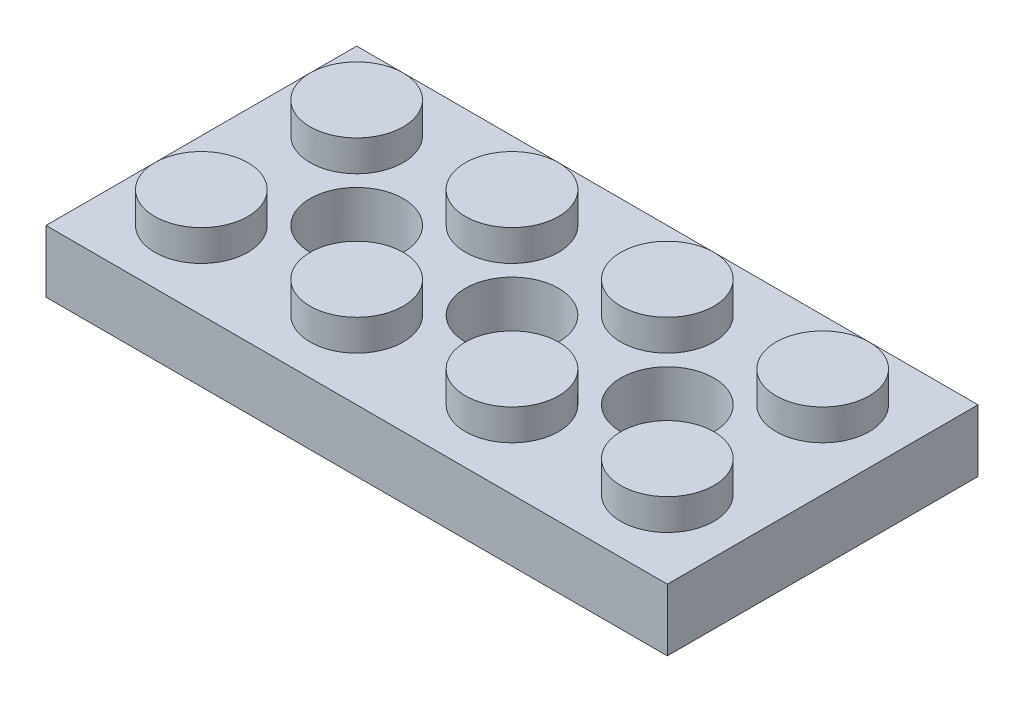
SolidWorks part; units mm, degrees
ref_plane "Front Plane" through (0, 0, 0) normal (0, 0, 1) x (1, 0, 0)
ref_plane "Top Plane" through (0, 0, 0) normal (0, 1, 0) x (1, 0, 0)
ref_plane "Right Plane" through (0, 0, 0) normal (1, 0, 0) x (0, 0, -1)
sketch "Sketch1" plane through (0, 0, 0) normal (0, 1, 0) x (1, 0, 0)
  line L5 (-16, -4) -> (16, -4)
  line L6 (-16, -4) -> (-16, 4)
  line L7 (-16, 4) -> (16, 4)
  line L8 (16, -4) -> (16, 4)
  line L9 (-16, -4) -> (16, 4) construction
  line L10 (-16, 4) -> (16, -4) construction
  point P0 (0, 0)
  dimension "D1" = 8
  dimension "D2" = 32
extrude "Boss-Extrude1" add sketch "Sketch1" along normal blind 3.2
sketch "Sketch2" plane through (0, 3.2, 0) normal (0, 1, 0) x (1, 0, 0)
  line L0 (-16, 4) -> (-16, -4) construction
  circle A2 centre (-12, 0) radius 2.4
  circle A6 centre (-4, 0) radius 2.4
  circle A7 centre (4, 0) radius 2.4
  circle A8 centre (12, 0) radius 2.4
  dimension "D1" = 4.8
  dimension "D2" = 4
extrude "Boss-Extrude2" add sketch "Sketch2" along normal blind 1.6
ref_plane "Plane1" through (0, 0, 4) normal (0, 0, 1) x (1, 0, 0)
mirror "Mirror2" about plane through (0, 0, 4) normal (0, 0, 1) of "Boss-Extrude1", "Boss-Extrude2"
shell "Shell1" thickness 1.6
sketch "Sketch9" plane through (0, 0, 0) normal (0, 1, 0) x (1, 0, 0)
  line L0 (14.4, -10.4) -> (14.4, 2.4) construction
  line L2 (14.4, 2.4) -> (-14.4, 2.4) construction
  circle A2 centre (8, -4) radius 3.21
  dimension "D1" = 6.4
  dimension "D2" = 6.4
  dimension "D3" = 6.42
extrude "Boss-Extrude5" add sketch "Sketch9" along normal up to surface (1.6 mm away)
sketch "Sketch7" plane through (0, 0, 0) normal (0, 1, 0) x (1, 0, 0)
  line L0 (14.4, -10.4) -> (-14.4, -10.4) construction
  line L4 (16, -12) -> (16, 4) construction
  circle A0 centre (8, -4) radius 2.4
  point P4 (12.3012, -4)
  point P5 (0, 0)
  dimension "D1" = 4.8
  dimension "D2" = 6.4
  dimension "D3" = 8
extrude "Cut-Extrude3" cut sketch "Sketch7" along normal through all
pattern_linear "LPattern3" count 3 spacing 8 along (-1, 0, 0) of "Cut-Extrude3", "Boss-Extrude5"
